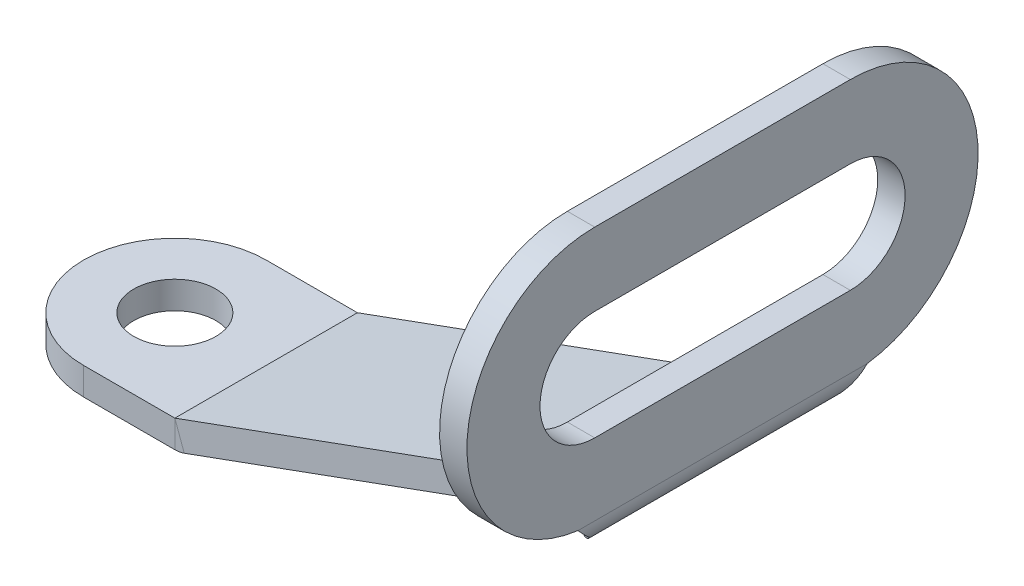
SolidWorks part; units mm, degrees
ref_plane "Front Plane" through (0, 0, 0) normal (0, 0, 1) x (1, 0, 0)
ref_plane "Top Plane" through (0, 0, 0) normal (0, 1, 0) x (1, 0, 0)
ref_plane "Right Plane" through (0, 0, 0) normal (1, 0, 0) x (0, 0, -1)
sketch "Sketch1" plane through (0, 0, 0) normal (0, 1, 0) x (1, 0, 0)
  line L0 (0, 0) -> (37, 0) construction
  line L1 (0, 5) -> (28, 5)
  line L2 (0, -5) -> (28, -5)
  line L3 (44, 7) -> (44, -7)
  line L4 (37, 7) -> (37, 0) construction
  line L5 (37, 0) -> (37, -7) construction
  line L6 (40, 7) -> (40, -7)
  line L7 (34, 7) -> (34, -7)
  arc A0 (0, 5) -> (0, -5) centre (0, 0) ccw
  arc A1 (40, 7) -> (34, 7) centre (37, 7) ccw
  arc A2 (34, -7) -> (40, -7) centre (37, -7) ccw
  arc A3 (30, -7) -> (44, -7) centre (37, -7) ccw
  arc A4 (44, 7) -> (30, 7) centre (37, 7) ccw
  arc A5 (30, -7) -> (28, -5) centre (28, -7) ccw
  arc A6 (28, 5) -> (30, 7) centre (28, 7) ccw
  circle A7 centre (0, 0) radius 2.25
  point P5 (-23.4512, -0.1406)
  dimension "D1" = 10
  dimension "D3" = 7
  dimension "D5" = 14
  dimension "D6" = 6
  dimension "D7" = 2
  dimension "D8" = 2
  dimension "D9" = 4.5
  dimension "D2" = 37
  dimension "D4" = 7
sheet metal parameters "Sheet-Metal1" thickness 1.5 parameters "D1"=0.1
base flange "Base-Flange1" sketch "Sketch1" thickness 1.5 reverse thickness direction yes parameters "D1"=0.1
sketch "Sketch3" plane through (0, 1.5, 0) normal (0, 1, 0) x (1, 0, 0)
  line L0 (30, 7) -> (30, -7)
sketched bend "Sketched Bend1" parameters "D1"=0.001
bend "SketchBend1" bend radius 0.1 bend angle 70 parameters "D5"=1
sketch "Sketch4" plane through (0, 1.5, 0) normal (0, 1, 0) x (1, 0, 0)
  line L0 (5, 5) -> (5, -5)
  line L1 (0, 5) -> (28, 5) construction
  line L2 (0, -5) -> (28, -5) construction
  arc A0 (0, 5) -> (0, -5) centre (0, 0) ccw construction
  dimension "D1" = 5
sketched bend "Sketched Bend3" parameters "D1"=0.001
bend "SketchBend3" bend radius 0.001 bend angle 20 parameters "D5"=2
flat pattern "Flat-Pattern1"
sketch "Bend-Lines1" plane through (0, 0, 0) normal (0, 1, 0) x (-1, 0, 0)
bend of the flat pattern "Flatten-<SketchBend1>1"
bend of the flat pattern "Flatten-<SketchBend3>1"
